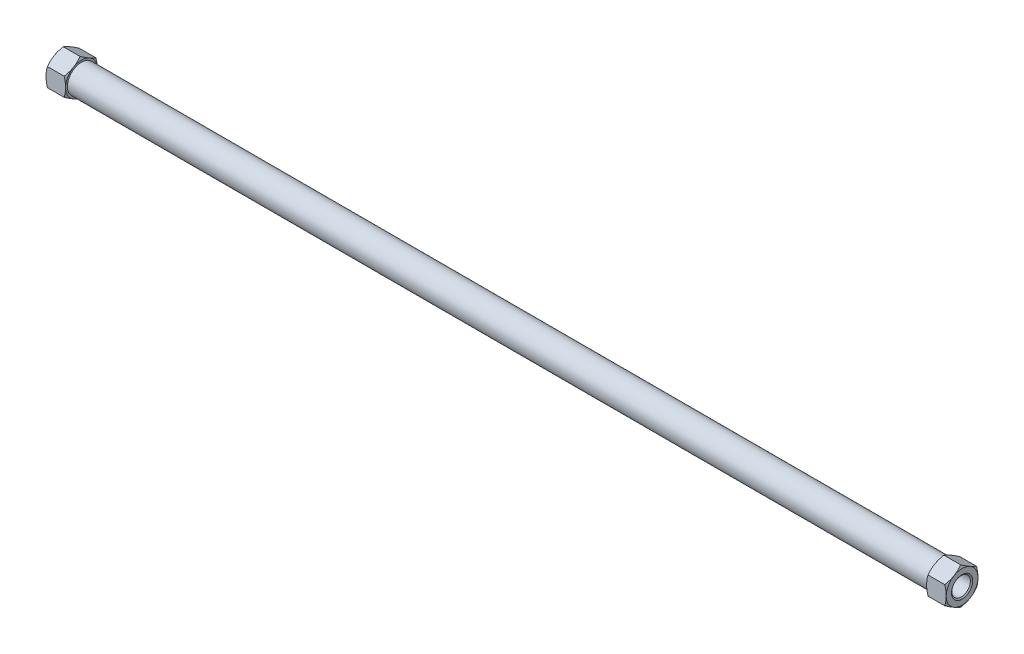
SolidWorks part; units mm, degrees
other "<Tige Tirant>-<Ecrou 2>"
other "<Tige Tirant>-<Ecrou>"
other "<Tige Tirant>-<Tirant>"
ref_plane "Plan de face" through (0, 0, 0) normal (0, 0, 1) x (1, 0, 0)
ref_plane "Plan de dessus" through (0, 0, 0) normal (0, 1, 0) x (1, 0, 0)
ref_plane "Plan de droite" through (0, 0, 0) normal (1, 0, 0) x (0, 0, -1)
mirrored part "Tige Tirant_Symétrique"
